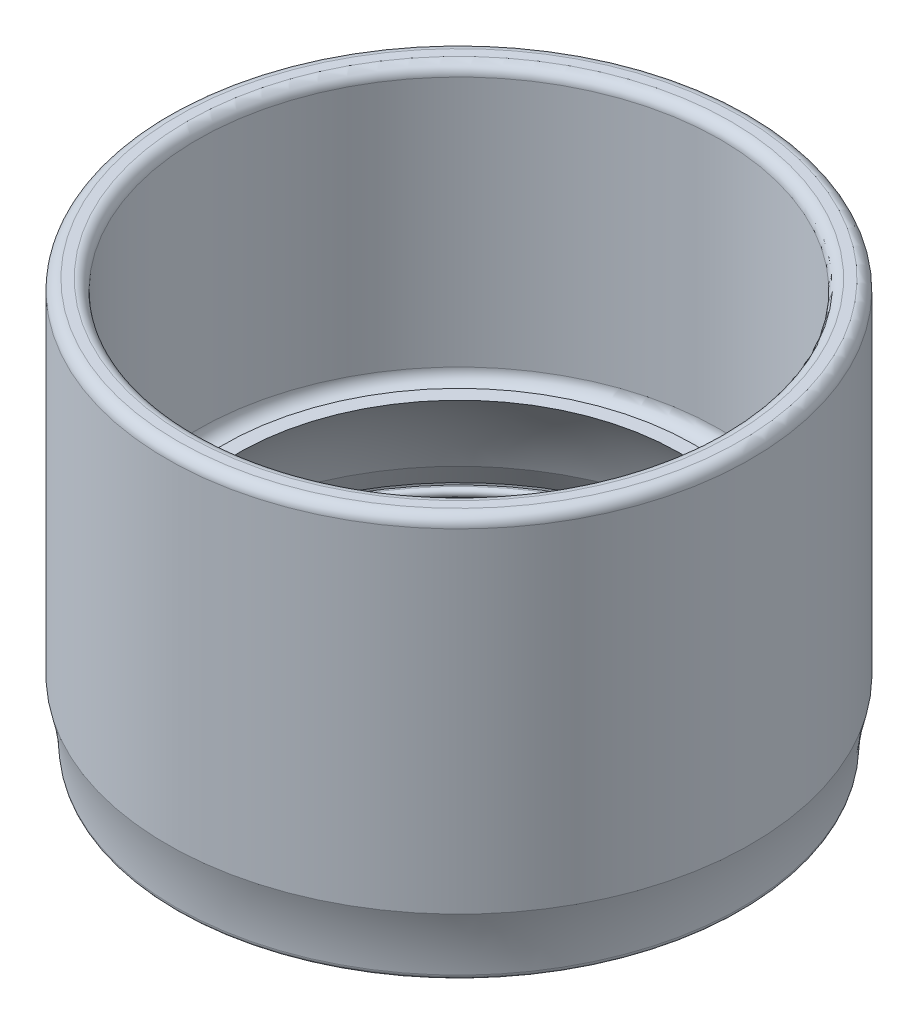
SolidWorks part; units mm, degrees
ref_plane "Plane1" through (0, 0, 0) normal (0, 0, 1) x (1, 0, 0)
ref_plane "Plane2" through (0, 0, 0) normal (0, 1, 0) x (1, 0, 0)
ref_plane "Plane3" through (0, 0, 0) normal (1, 0, 0) x (0, 0, -1)
sketch "Sketch1" plane through (0, 0, 0) normal (0, 0, 1) x (1, 0, 0)
  line L0 (-79.756, 18.1864) -> (-82.7532, 11.7602)
  line L1 (-85.8012, 0) -> (-81.9912, 0)
  line L2 (-88.5952, 123.9012) -> (-79.375, 123.9012)
  line L3 (-79.375, 123.9012) -> (-79.375, 44.5262)
  line L4 (-71.44, 44.5262) -> (-67.0306, 44.5262)
  line L5 (-82.7532, 11.7602) -> (-82.7532, 11.1252)
  line L6 (0, 0) -> (0, 127) construction
  line L7 (-82.7532, 11.1252) -> (-82.2198, 11.1252)
  line L10 (-88.5952, 123.9012) -> (-88.5952, 19.5072)
  line L12 (-81.8642, 8.636) -> (-81.9912, 8.636)
  line L13 (-81.9912, 8.636) -> (-81.9912, 0)
  arc A0 (-67.0306, 44.5262) -> (-79.756, 18.1864) centre (0.0859, -4.1433) ccw
  arc A1 (-79.375, 44.5262) -> (-71.44, 44.5262) centre (-75.4075, 44.5262) ccw
  arc A2 (-82.2198, 11.1252) -> (-81.8642, 8.636) centre (-82.2198, 9.8552) cw
  arc A3 (-88.5952, 19.5072) -> (-85.8012, 0) centre (-161.9444, -0.9522) cw
  dimension "D1" = 81.9912
  dimension "D2" = 85.8012
  dimension "D5" = 123.9012
  dimension "D6" = 76.1492
  dimension "D9" = 3.9675
  dimension "D11" = 82.9056
  dimension "D19" = 1.27
  dimension "D3" = 88.5952
  dimension "D4" = 79.375
  dimension "D7" = 104.394
  dimension "D8" = 79.375
  dimension "D10" = 67.0306
  dimension "D12" = 105.7148
  dimension "D13" = 115.2652
  dimension "D14" = 79.756
  dimension "D15" = 64.996
  dimension "D16" = 0.635
  dimension "D17" = 112.141
  dimension "D18" = 82.2198
revolve "Base-Revolve" add sketch "Sketch1" angle 360 about L6
fillet "Fillet2" radius 3.175
fillet "Fillet7" radius 3.175
fillet "Fillet8" radius 1.5875
